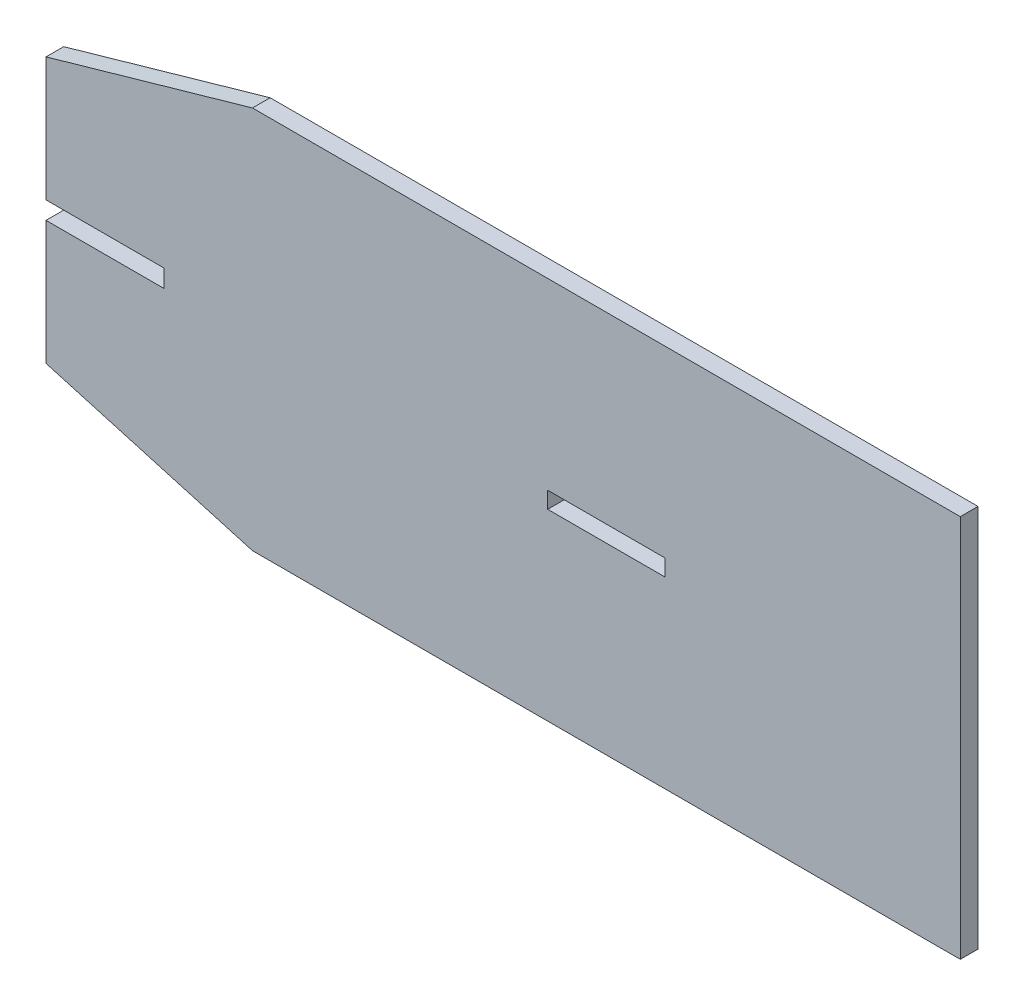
SolidWorks part; units mm, degrees
ref_plane "Alzado" through (0, 0, 0) normal (0, 0, 1) x (1, 0, 0)
ref_plane "Planta" through (0, 0, 0) normal (0, 1, 0) x (1, 0, 0)
ref_plane "Vista lateral" through (0, 0, 0) normal (1, 0, 0) x (0, 0, -1)
sketch "Croquis1" plane through (0, 0, 0) normal (0, 0, 1) x (1, 0, 0)
  line L0 (-60, 32.5) -> (-95, 22.5)
  line L1 (60, -32.5) -> (-60, -32.5)
  line L2 (60, -32.5) -> (60, 32.5)
  line L3 (60, 32.5) -> (-60, 32.5)
  line L5 (60, -32.5) -> (-60, 32.5) construction
  line L6 (60, 32.5) -> (-60, -32.5) construction
  line L7 (-95, 22.5) -> (-95, 1.5)
  line L8 (-95, 1.5) -> (-75, 1.5)
  line L9 (-75, 1.5) -> (-75, -1.5)
  line L10 (0, 0) -> (-105.4012, 0) construction
  line L11 (-60, -32.5) -> (-95, -22.5)
  line L12 (-95, -22.5) -> (-95, -1.5)
  line L13 (-95, -1.5) -> (-75, -1.5)
  point P0 (0, 0)
  point P15 (-75, 0)
  dimension "D1" = 65
  dimension "D2" = 120
  dimension "D3" = 45
  dimension "D4" = 3
  dimension "D5" = 35
  dimension "D6" = 20
extrude "Saliente-Extruir1" add sketch "Croquis1" along normal blind 3
sketch "Croquis2" plane through (0, 0, 3) normal (0, 0, 1) x (1, 0, 0)
  line L1 (9.95, -1.4) -> (-9.95, -1.4)
  line L2 (9.95, -1.4) -> (9.95, 1.4)
  line L3 (9.95, 1.4) -> (-9.95, 1.4)
  line L4 (-9.95, -1.4) -> (-9.95, 1.4)
  line L5 (9.95, -1.4) -> (-9.95, 1.4) construction
  line L6 (9.95, 1.4) -> (-9.95, -1.4) construction
  point P0 (0, 0)
  dimension "D1" = 2.8
  dimension "D2" = 19.9
extrude "Cortar-Extruir1" cut sketch "Croquis2" against normal blind 3
